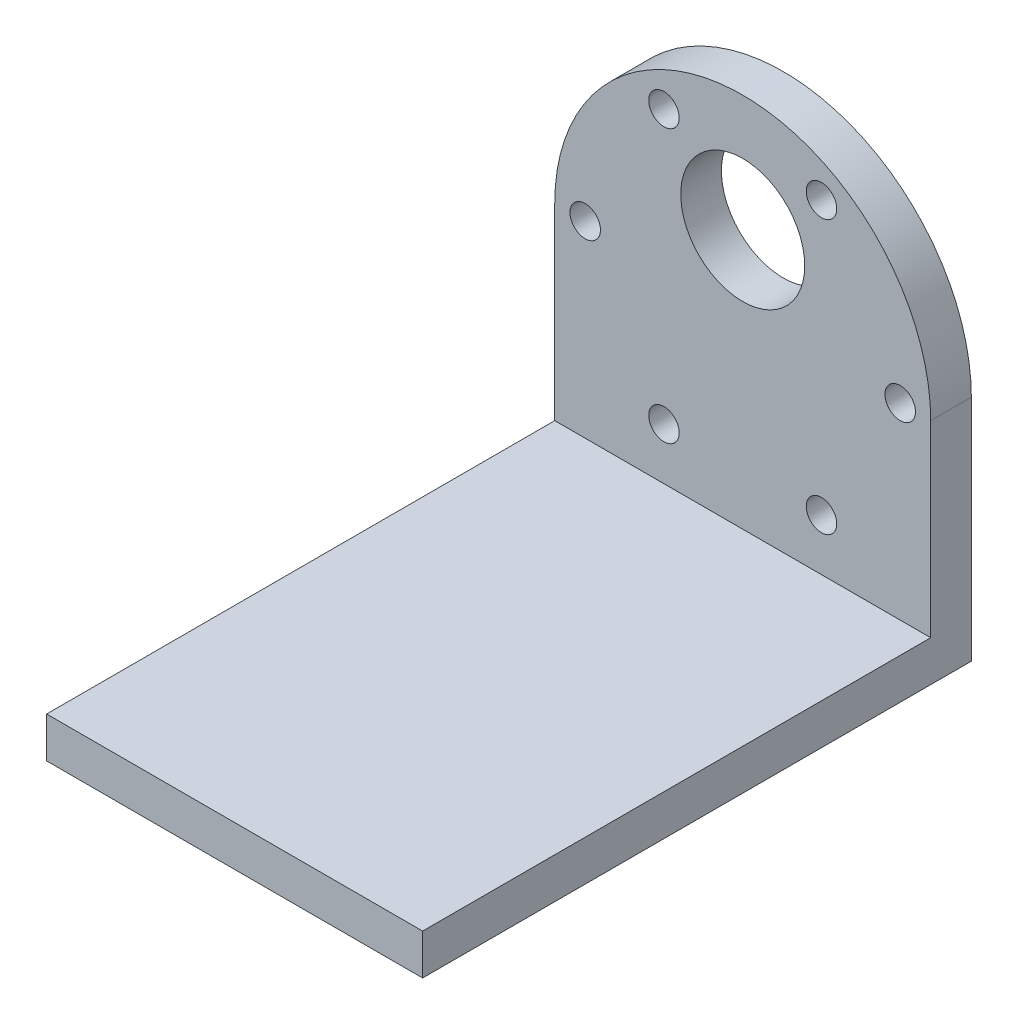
SolidWorks part; units mm, degrees
ref_plane "Plan de face" through (0, 0, 0) normal (0, 0, 1) x (1, 0, 0)
ref_plane "Plan de dessus" through (0, 0, 0) normal (0, 1, 0) x (1, 0, 0)
ref_plane "Plan de droite" through (0, 0, 0) normal (1, 0, 0) x (0, 0, -1)
sketch "Esquisse1" plane through (0, 0, 0) normal (0, 0, 1) x (1, 0, 0)
  line L0 (0, 22.5) -> (0, 0)
  line L1 (0, 0) -> (37, 0)
  line L2 (37, 0) -> (37, 22.5)
  arc A0 (37, 22.5) -> (0, 22.5) centre (18.5, 22.5) ccw
  circle A1 centre (3, 22.5) radius 1.5
  circle A4 centre (18.5, 29.5) radius 6.1
  circle A8 centre (18.5, 22.5) radius 15.5 construction
  circle A14 centre (10.75, 35.9234) radius 1.5
  circle A15 centre (26.25, 35.9234) radius 1.5
  circle A16 centre (34, 22.5) radius 1.5
  circle A17 centre (26.25, 9.0766) radius 1.5
  circle A18 centre (10.75, 9.0766) radius 1.5
  point P7 (10.7384, 38.4167)
  point P19 (18.5, 0)
  point P24 (18.5, 22.5)
  dimension "D3" = 12.2
  dimension "D5" = 31
  dimension "D6" = 3
  dimension "D1" = 37
  dimension "D2" = 22.5
  dimension "D4" = 7
  dimension "D8" = 15.5
  dimension "D7" = 6
extrude "Boss.-Extru.1" add sketch "Esquisse1" along normal blind 4
sketch "Esquisse2" plane through (0, 0, 4) normal (0, 0, 1) x (1, 0, 0)
  line L0 (37, 0) -> (37, 22.5) construction
  line L1 (0, 0) -> (37, 0)
  line L2 (0, 0) -> (0, 4)
  line L3 (0, 4) -> (37, 4)
  line L4 (37, 0) -> (37, 4)
  dimension "D1" = 4
extrude "Boss.-Extru.2" add sketch "Esquisse2" along normal blind 50
